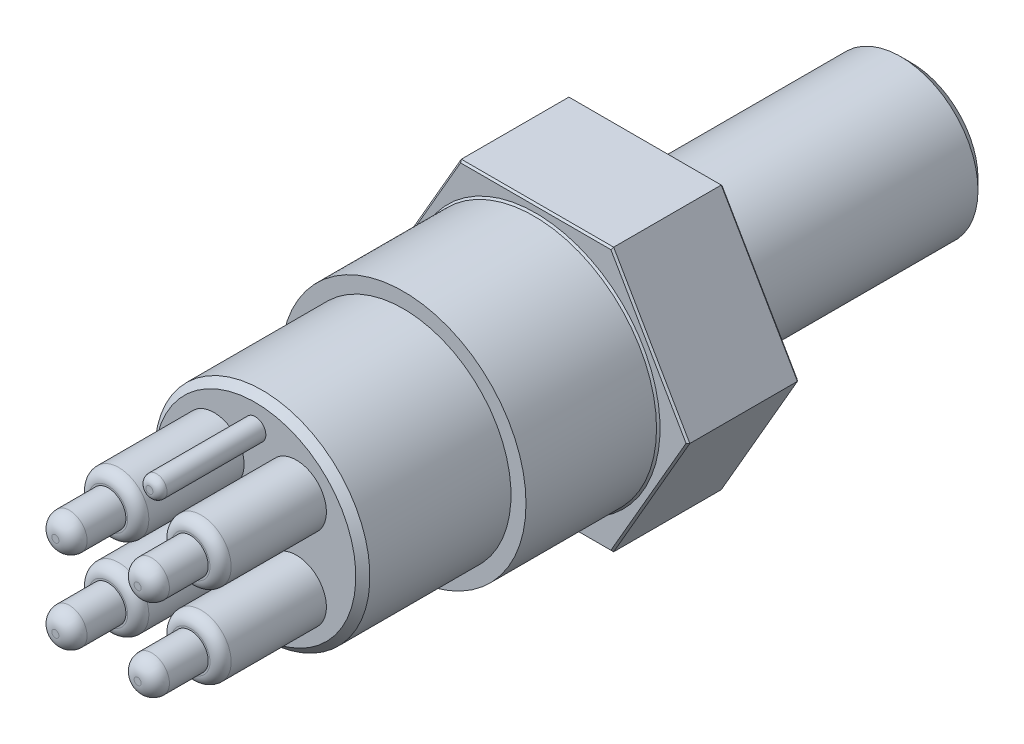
SolidWorks part; units mm, degrees
ref_plane "Front" through (0, 0, 0) normal (0, 0, 1) x (1, 0, 0)
ref_plane "Top" through (0, 0, 0) normal (0, 1, 0) x (1, 0, 0)
ref_plane "Right" through (0, 0, 0) normal (1, 0, 0) x (0, 0, -1)
sketch "Sketch1" plane through (0, 0, 0) normal (0, 0, 1) x (1, 0, 0)
  circle A0 centre (0, 0) radius 5.5562
  dimension "D1" = 11.1125
extrude "post" add sketch "Sketch1" against normal blind 19.05
chamfer "Chamfer1" distance 0.762 angle 45
sketch "Sketch2" plane through (0, 0, 0) normal (0, 0, 1) x (1, 0, 0)
  line L1 (-5.4846, 9.4996) -> (-10.9692, 0)
  line L2 (-10.9692, 0) -> (-5.4846, -9.4996)
  line L3 (-5.4846, -9.4996) -> (5.4846, -9.4996)
  line L4 (5.4846, -9.4996) -> (10.9692, 0)
  line L5 (10.9692, 0) -> (5.4846, 9.4996)
  line L6 (5.4846, 9.4996) -> (-5.4846, 9.4996)
  circle A0 centre (0, 0) radius 9.4996 construction
  dimension "D1" = 18.9992
extrude "hex" add sketch "Sketch2" along normal blind 8.001
sketch "Sketch5" plane through (0, 0, 8.001) normal (0, 0, 1) x (1, 0, 0)
  circle A0 centre (0, 0) radius 8.8265
  dimension "D1" = 17.653
extrude "Extrude1" add sketch "Sketch5" along normal blind 9.525
chamfer "Chamfer2" distance 0.127 angle 45
sketch "Sketch3" plane through (0, 0, 17.526) normal (0, 0, 1) x (1, 0, 0)
  circle A0 centre (0, 0) radius 7.747
  dimension "D1" = 15.494
extrude "rubber" add sketch "Sketch3" along normal blind 10.668
chamfer "Chamfer3" distance 0.508 angle 45
sketch "Sketch4" plane through (0, 0, 28.194) normal (0, 0, 1) x (1, 0, 0)
  line L0 (0, 6.6112) -> (0, -6.1992) construction
  line L3 (0, 0) -> (7.506, 7.506) construction
  line L4 (0, 0) -> (-6.8526, -6.8526) construction
  line L5 (0, 0) -> (7.6052, -7.6052) construction
  line L6 (0, 0) -> (-7.5761, 7.5761) construction
  circle A0 centre (0, 0) radius 4.191 construction
  circle A1 centre (0, 5.588) radius 0.762
  circle A3 centre (2.9635, -2.9635) radius 2.159
  circle A4 centre (-2.9635, 2.9635) radius 2.159
  circle A5 centre (-2.9635, -2.9635) radius 2.159
  circle A6 centre (2.9635, 2.9635) radius 2.159
  dimension "D1" = 8.382
  dimension "D2" = 45
  dimension "D3" = 4.318
  dimension "D4" = 4.318
  dimension "D5" = 4.318
  dimension "D6" = 4.318
  dimension "D7" = 1.524
  dimension "D8" = 5.588
extrude "PINS" add sketch "Sketch4" along normal blind 7.62
sketch "Sketch6" plane through (0, 0, 35.814) normal (0, 0, 1) x (1, 0, 0)
  circle A0 centre (-2.9635, 2.9635) radius 1.27
  circle A1 centre (-2.9635, -2.9635) radius 1.27
  circle A2 centre (2.9635, 2.9635) radius 1.27
  circle A3 centre (2.9635, -2.9635) radius 1.27
  dimension "D1" = 2.54
  dimension "D2" = 2.54
  dimension "D3" = 2.54
  dimension "D4" = 2.54
extrude "pin tips" add sketch "Sketch6" along normal blind 3.81
fillet "pin tip radius" radius 1.016
fillet "guide pit tip" radius 0.508
fillet "Fillet3" radius 0.762
